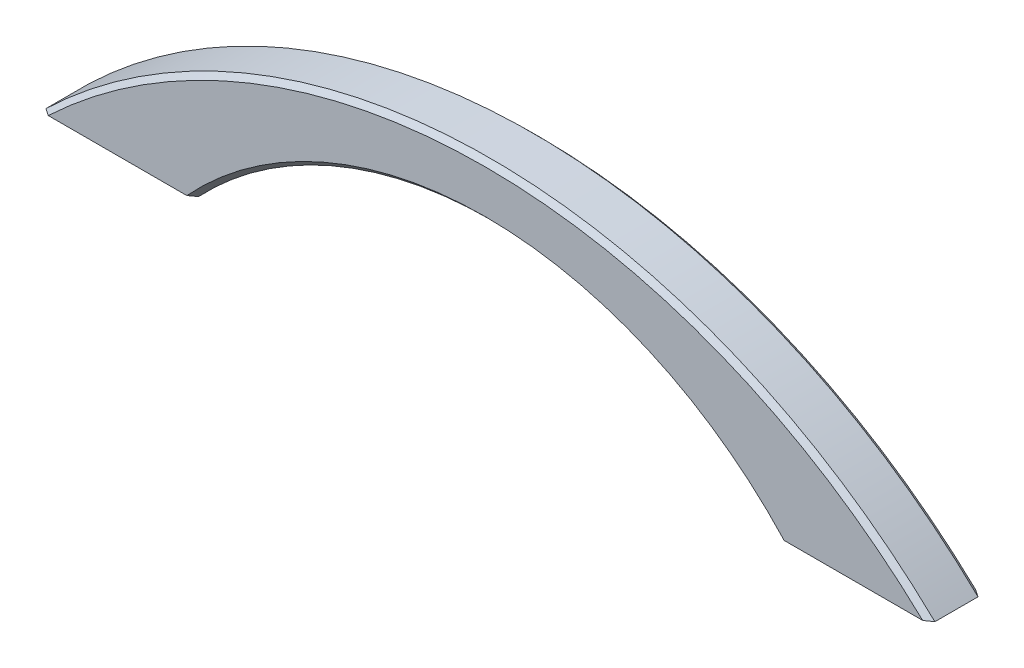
SolidWorks part; units mm, degrees
ref_plane "正面" through (0, 0, 0) normal (0, 0, 1) x (1, 0, 0)
ref_plane "平面" through (0, 0, 0) normal (0, 1, 0) x (1, 0, 0)
ref_plane "右側面" through (0, 0, 0) normal (1, 0, 0) x (0, 0, -1)
sketch "ｽｹｯﾁ1" plane through (0, 0, 0) normal (0, 0, 1) x (1, 0, 0)
  line L0 (-44, 0) -> (-67, 0)
  line L1 (67, 0) -> (44, 0)
  line L2 (0, 0) -> (0, 70.3267) construction
  arc A0 (-67, 0) -> (67, 0) centre (0, -69.6296) cw
  arc A1 (-44, 0) -> (44, 0) centre (0, -41.4474) cw
  dimension "D3" = 8
  dimension "D4" = 27
  dimension "D1" = 134
  dimension "D2" = 88
extrude "ﾎﾞｽ - 押し出し1" add sketch "ｽｹｯﾁ1" along normal mid plane 8
hole_wizard "M4x0.7 ねじ穴1" positions "ｽｹｯﾁ2" profile "ｽｹｯﾁ3" tap size "M4x0.7" standard "Ansi Metric"
sketch "ｽｹｯﾁ2" plane through (0, 0, 0) normal (0, -1, 0) x (-1, 0, 0)
  line L0 (50, 0) -> (-50, 0) construction
  point P0 (50, 0)
  point P2 (-50, 0)
  dimension "D1" = 100
sketch "ｽｹｯﾁ3" plane through (-50, 0, 0) normal (1, 0, 0) x (0, 0, -1)
  line L0 (0, 0) -> (0, 6.9914)
  line L1 (0, 6.9914) -> (1.65, 6)
  line L2 (1.65, 6) -> (1.65, 0)
  line L5 (1.65, 0) -> (0, 0)
  line L10 (0, 6.9914) -> (-1.65, 6) construction
  line L11 (0, -6.35) -> (0, 107.95) construction
  dimension "ねじ下穴ﾄﾞﾘﾙ直径" = 3.3
  dimension "ねじ下穴ﾄﾞﾘﾙの深さ" = 6
  dimension "ﾄﾞﾘﾙ角度" = 118
chamfer "面取り1" distance 0.75 angle 45 4 edges at (0, 27, -4) (0, 27, 4) (0, 19, -4) (0, 19, 4)
